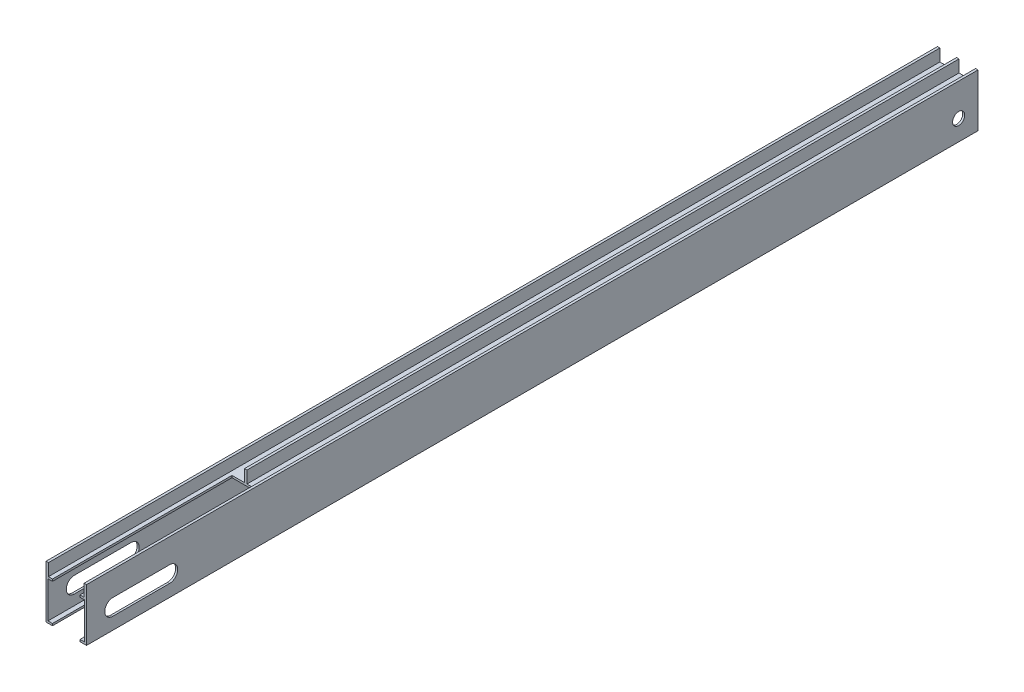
SolidWorks part; units mm, degrees
ref_plane "Plan de face" through (0, 0, 0) normal (0, 0, 1) x (1, 0, 0)
ref_plane "Plan de dessus" through (0, 0, 0) normal (0, 1, 0) x (1, 0, 0)
ref_plane "Plan de droite" through (0, 0, 0) normal (1, 0, 0) x (0, 0, -1)
sketch "Esquisse1" plane through (0, 0, 0) normal (0, 0, 1) x (1, 0, 0)
  line L0 (45, 45) -> (-45, 45)
  line L1 (50, -50) -> (-50, -50)
  line L2 (50, -50) -> (50, 50)
  line L3 (50, 50) -> (-50, 50)
  line L4 (-50, -50) -> (-50, 50)
  line L5 (50, -50) -> (-50, 50) construction
  line L6 (50, 50) -> (-50, -50) construction
  line L7 (-45, -45) -> (-45, 45)
  line L8 (45, -45) -> (-45, -45)
  line L9 (45, -45) -> (45, 45)
  point P0 (0, 0)
  dimension "D1" = 100
  dimension "D2" = 100
  dimension "D3" = 5
extrude "Boss.-Extru.1" add sketch "Esquisse1" along normal blind 2200
sketch "Esquisse2" plane through (0, 0, 0) normal (0, 0, -1) x (-1, 0, 0)
  line L0 (-50, 50) -> (50, 50) construction
  line L1 (-50, 50) -> (-50, 80)
  line L8 (-50, 80) -> (-44, 80)
  line L9 (-44, 50) -> (-44, 80)
  line L10 (-47, 50) -> (-44, 80) construction
  line L11 (-50, 80) -> (-47, 50) construction
  line L12 (-50, 50) -> (-44, 50)
  line L13 (-50, -50) -> (-50, 50) construction
  line L14 (44, 50) -> (44, 80)
  line L15 (44, 80) -> (50, 80)
  line L16 (50, 50) -> (50, 80)
  line L17 (47, 50) -> (50, 80) construction
  line L18 (44, 80) -> (47, 50) construction
  line L19 (44, 50) -> (50, 50)
  line L20 (50, 50) -> (50, -50) construction
  point P2 (-47, 50)
  point P16 (47, 50)
  dimension "D1" = 30
  dimension "D4" = 3
  dimension "D5" = 3
  dimension "D6" = 3
  dimension "D7" = 3
extrude "Boss.-Extru.2" add sketch "Esquisse2" against normal blind 2200
sketch "Esquisse3" plane through (0, 0, 0) normal (0, 0, -1) x (-1, 0, 0)
  line L0 (45, -45) -> (-45, -45) construction
  line L1 (-45, -17.3056) -> (45, -17.3056)
  line L2 (-45, -17.3056) -> (-45, -72.6944)
  line L3 (-45, -72.6944) -> (45, -72.6944)
  line L4 (45, -17.3056) -> (45, -72.6944)
  line L5 (-45, -17.3056) -> (45, -72.6944) construction
  line L6 (-45, -72.6944) -> (45, -17.3056) construction
  point P0 (0, -45)
extrude "Enlèv. mat.-Extru.1" cut sketch "Esquisse3" against normal blind 103
sketch "Esquisse4" plane through (50, 0, 0) normal (1, 0, 0) x (0, 0, -1)
  line L0 (0, -50) -> (0, 80) construction
  line L1 (-2200, 50) -> (0, 50) construction
  circle A0 centre (-47.697, 0) radius 15
  point P2 (0, 15)
  dimension "D1" = 30
  dimension "D2" = 50
  dimension "D3" = 50
extrude "Enlèv. mat.-Extru.2" cut sketch "Esquisse4" against normal blind 122
sketch "Esquisse5" plane through (50, 0, 0) normal (1, 0, 0) x (0, 0, -1)
  line L0 (-2200, 0) -> (507.8352, 0) construction
  line L1 (-2200, -50) -> (-2200, 80) construction
  line L2 (-2135, 20) -> (-1995, 20)
  line L3 (-2135, -20) -> (-1995, -20)
  arc A0 (-1995, -20) -> (-1995, 20) centre (-1995, 0) ccw
  arc A1 (-2135, 20) -> (-2135, -20) centre (-2135, 0) ccw
  dimension "D3" = 20
  dimension "D4" = 65
  dimension "D1" = 40
  dimension "D2" = 140
extrude "Enlèv. mat.-Extru.3" cut sketch "Esquisse5" against normal blind 357
sketch "Esquisse7" plane through (0, 0, 2200) normal (0, 0, 1) x (1, 0, 0)
  line L0 (-44, 50) -> (-44, 80) construction
  line L1 (-34, 59.3202) -> (34, 59.3202)
  line L2 (-34, 59.3202) -> (-34, -57.8684)
  line L3 (-34, -57.8684) -> (34, -57.8684)
  line L4 (34, 59.3202) -> (34, -57.8684)
  line L5 (44, 50) -> (44, 80) construction
  dimension "D1" = 10
  dimension "D2" = 10
extrude "Enlèv. mat.-Extru.5" cut sketch "Esquisse7" against normal blind 443
sketch "Esquisse8" plane through (0, 0, 1757) normal (0, 0, 1) x (1, 0, 0)
  line L0 (34, 50) -> (-34, 50) construction
  line L1 (-3, 50) -> (3, 50)
  line L2 (-3, 50) -> (-3, 80)
  line L3 (-3, 80) -> (3, 80)
  line L4 (3, 50) -> (3, 80)
  line L5 (-44, 50) -> (-44, 80) construction
  point P9 (0, 50)
  dimension "D1" = 6
  dimension "D2" = 41
  dimension "D3" = 30
extrude "Boss.-Extru.3" add sketch "Esquisse8" against normal up to surface (1757 mm away)
